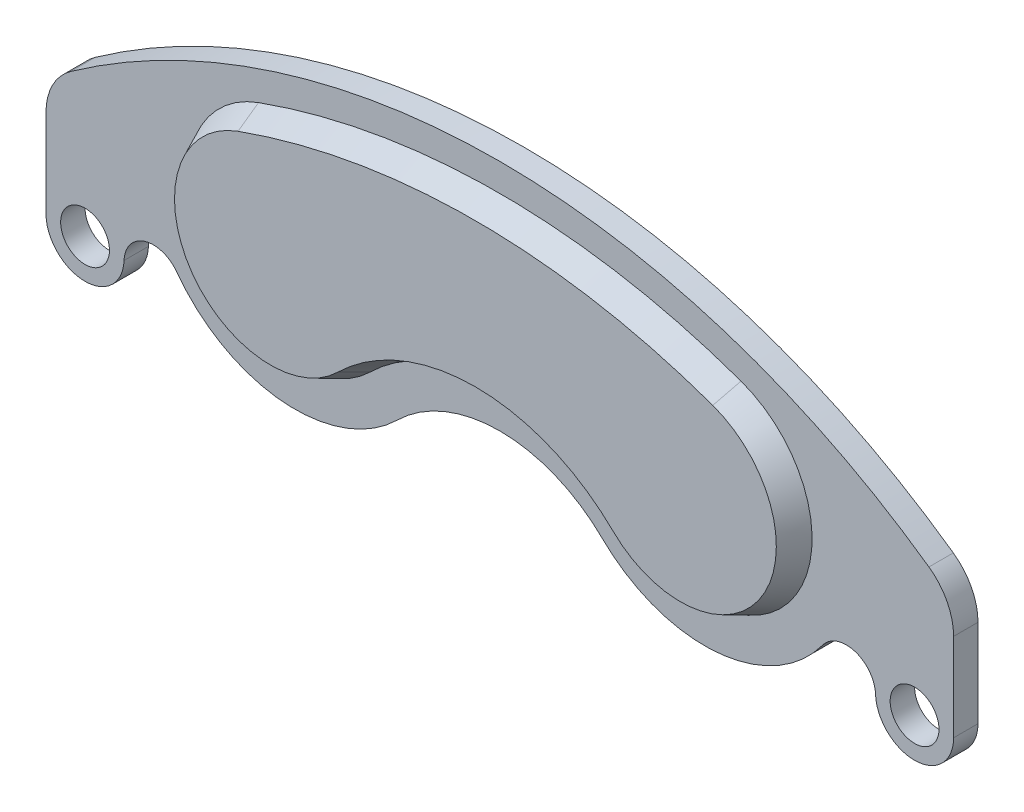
SolidWorks part; units mm, degrees
ref_plane "Front Plane" through (0, 0, 0) normal (0, 0, 1) x (1, 0, 0)
ref_plane "Top Plane" through (0, 0, 0) normal (0, 1, 0) x (1, 0, 0)
ref_plane "Right Plane" through (0, 0, 0) normal (1, 0, 0) x (0, 0, -1)
sketch "Sketch1" plane through (0, 0, 0) normal (0, 0, 1) x (1, 0, 0)
  line L2 (-46.5, 57.0942) -> (-46.5, 48.0942)
  line L3 (46.5, 57.0942) -> (46.5, 48.0942)
  arc A10 (43.9714, 61.988) -> (-43.9714, 61.988) centre (0, 0) ccw
  arc A11 (43.9714, 61.988) -> (46.5, 57.0942) centre (40.5, 57.0942) cw
  arc A12 (-43.9714, 61.988) -> (-46.5, 57.0942) centre (-40.5, 57.0942) ccw
  arc A13 (-46.5, 48.0942) -> (-38.5026, 47.9495) centre (-42.5, 48.0942) ccw
  arc A14 (-38.5026, 47.9495) -> (-33.0872, 49.6174) centre (-35.5046, 47.8409) cw
  arc A15 (-33.0872, 49.6174) -> (-10.5, 47.7879) centre (-21, 58.5) ccw
  arc A16 (46.5, 48.0942) -> (38.5026, 47.9495) centre (42.5, 48.0942) cw
  arc A17 (38.5026, 47.9495) -> (33.0872, 49.6174) centre (35.5046, 47.8409) ccw
  arc A18 (33.0872, 49.6174) -> (10.5, 47.7879) centre (21, 58.5) cw
  arc A19 (-10.5, 47.7879) -> (10.5, 47.7879) centre (0, 37.0757) cw
  dimension "D1" = 76
  dimension "D2" = 6
  dimension "D3" = 9
  dimension "D5" = 3
  dimension "D6" = 15
  dimension "D7" = 58.5
  dimension "D4" = 4
  dimension "D8" = 85
  dimension "D9" = 42
extrude "Boss-Extrude1" add sketch "Sketch1" along normal blind 2.5
sketch "Sketch3" plane through (0, 0, 2.5) normal (0, 0, 1) x (1, 0, 0)
  arc A0 (24.7165, 68.8531) -> (-24.7165, 68.8531) centre (0, 0) ccw
  arc A1 (-24.7165, 68.8531) -> (-13.3, 50.6444) centre (-21, 58.5) ccw
  arc A2 (13.3, 50.6444) -> (24.7165, 68.8531) centre (21, 58.5) ccw
  arc A3 (13.3, 50.6444) -> (-13.3, 50.6444) centre (0, 37.0757) ccw
  arc A4 (10.5, 47.7879) -> (-10.5, 47.7879) centre (0, 37.0757) ccw construction
  dimension "D1" = 11
extrude "Boss-Extrude2" add sketch "Sketch3" along normal blind 2.5 draft 25
sketch "Sketch4" plane through (0, 0, 2.5) normal (0, 0, 1) x (1, 0, 0)
  circle A0 centre (-42.5, 48.0942) radius 2.5
  circle A1 centre (42.5, 48.0942) radius 2.5
  dimension "D1" = 5
extrude "Cut-Extrude1" cut sketch "Sketch4" against normal through all
